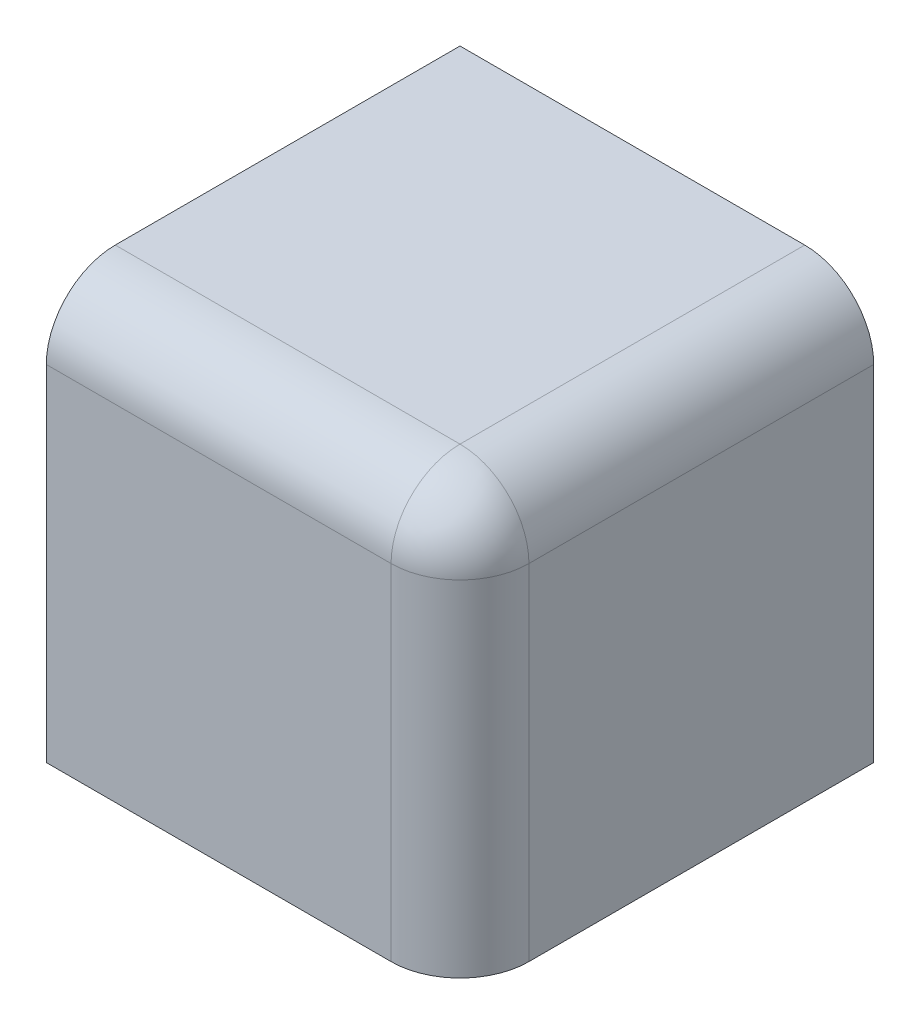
SolidWorks part; units mm, degrees
ref_plane "Front Plane" through (0, 0, 0) normal (0, 0, 1) x (1, 0, 0)
ref_plane "Top Plane" through (0, 0, 0) normal (0, 1, 0) x (1, 0, 0)
ref_plane "Right Plane" through (0, 0, 0) normal (1, 0, 0) x (0, 0, -1)
sketch "Sketch1" plane through (0, 0, 0) normal (0, 1, 0) x (1, 0, 0)
  line L1 (-76.2, -76.2) -> (76.2, -76.2)
  line L2 (-76.2, -76.2) -> (-76.2, 76.2)
  line L3 (-76.2, 76.2) -> (76.2, 76.2)
  line L4 (76.2, -76.2) -> (76.2, 76.2)
  line L5 (-76.2, -76.2) -> (76.2, 76.2) construction
  line L6 (-76.2, 76.2) -> (76.2, -76.2) construction
  point P0 (0, 0)
  dimension "D1" = 152.4
extrude "Boss-Extrude1" add sketch "Sketch1" along normal blind 152.4
fillet "Fillet1" radius 25.4 3 edges at (76.2, 76.2, 76.2) (76.2, 152.4, 0) (0, 152.4, 76.2)
sketch "Sketch2" plane through (0, 0, 76.2) normal (0, 0, 1) x (1, 0, 0)
  line L0 (0, 152.4) -> (0, 127)
  line L1 (-76.2, 152.4) -> (50.8, 152.4) construction
  line L2 (50.8, 127) -> (-76.2, 127) construction
  line L3 (0, 127) -> (-76.2, 127) construction
  line L4 (50.8, 0) -> (50.8, 76.2) construction
  line L5 (50.8, 0) -> (50.8, 127) construction
  line L6 (50.8, 76.2) -> (76.2, 76.2)
  line L7 (76.2, 127) -> (76.2, 0) construction
  arc A0 (0, 127) -> (50.8, 76.2) centre (0, 76.2) cw
  dimension "D1" = 76.2
sketch "Sketch3" plane through (76.2, 0, 0) normal (1, 0, 0) x (0, 0, -1)
  line L0 (-76.2, 76.2) -> (-50.8, 76.2)
  line L1 (-76.2, 127) -> (-76.2, 76.2) construction
  line L2 (-76.2, 0) -> (-76.2, 76.2) construction
  line L3 (-50.8, 127) -> (-50.8, 0) construction
  line L4 (-50.8, 76.2) -> (-50.8, 0) construction
  line L6 (92.6827, 56.172) -> (93.1088, 55.9589)
  line L7 (76.2, 127) -> (0, 127) construction
  line L8 (76.2, 127) -> (-50.8, 127) construction
  line L9 (0, 127) -> (0, 152.4)
  line L10 (-50.8, 152.4) -> (76.2, 152.4) construction
  arc A0 (-50.8, 76.2) -> (0, 127) centre (0, 76.2) cw
sketch "Sketch4" plane through (0, 152.4, 0) normal (0, 1, 0) x (1, 0, 0)
  line L0 (76.2, 0) -> (50.8, 0) construction
  line L1 (76.2, -50.8) -> (76.2, 0) construction
  line L2 (50.8, -50.8) -> (50.8, 76.2) construction
  line L3 (50.8, 0) -> (50.8, 76.2) construction
  line L4 (0, -76.2) -> (0, -50.8) construction
  line L5 (0, -76.2) -> (50.8, -76.2) construction
  line L6 (0, -76.2) -> (-76.2, -76.2) construction
  line L7 (-76.2, -50.8) -> (50.8, -50.8) construction
  line L8 (0, -50.8) -> (-76.2, -50.8) construction
  arc A0 (0, -50.8) -> (50.8, 0) centre (0, 0) ccw
